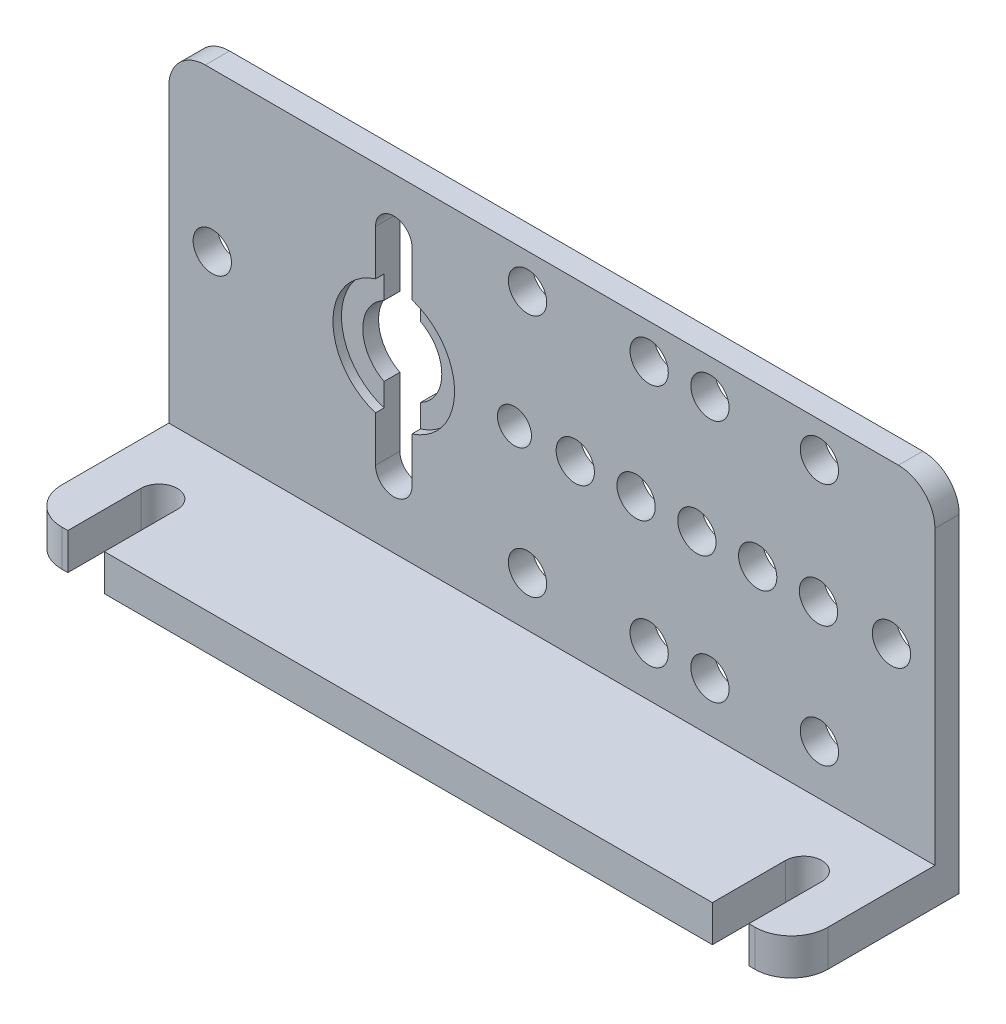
SolidWorks part; units mm, degrees
ref_plane "Plan1" through (0, 0, 0) normal (0, 0, 1) x (1, 0, 0)
ref_plane "Plan2" through (0, 0, 0) normal (0, 1, 0) x (1, 0, 0)
ref_plane "Plan3" through (0, 0, 0) normal (1, 0, 0) x (0, 0, -1)
sketch "Esquisse1" plane through (0, 0, 0) normal (0, 0, 1) x (1, 0, 0)
  line L0 (0, 0) -> (0, 27)
  line L1 (3, 30) -> (60, 30)
  line L2 (63, 27) -> (63, 0)
  line L3 (63, 0) -> (0, 0)
  arc A0 (63, 27) -> (60, 30) centre (60, 27) ccw
  arc A1 (0, 27) -> (3, 30) centre (3, 27) cw
  point P6 (63, 30)
  point P9 (0, 30)
  dimension "D3" = 3
  dimension "D1" = 30
  dimension "D2" = 63
extrude "Base-Extrusion" add sketch "Esquisse1" along normal blind 2
sketch "Esquisse2" plane through (0, 0, 0) normal (0, 1, 0) x (1, 0, 0)
  line L1 (0, -2) -> (63, -2)
  line L3 (0, -2) -> (0, -10.8)
  line L4 (3, -13.8) -> (60, -13.8)
  line L5 (63, -2) -> (63, -10.8)
  arc A0 (3, -13.8) -> (0, -10.8) centre (3, -10.8) cw
  arc A1 (63, -10.8) -> (60, -13.8) centre (60, -10.8) cw
  dimension "D1" = 3
  dimension "D2" = 11.8
  dimension "D3" = 63
extrude "Boss.-Extru.1" add sketch "Esquisse2" along normal blind 3
sketch "Esquisse5" plane through (0, 0, 2) normal (0, 0, 1) x (1, 0, 0)
  line L0 (17, 25.5) -> (17, 19.8831)
  line L1 (20, 25.5) -> (20, 19.8831)
  line L2 (20, 14.1169) -> (20, 8.5)
  line L3 (17, 14.1169) -> (17, 8.5)
  line L4 (60, 30) -> (3, 30) construction
  line L5 (0, 27) -> (0, 3) construction
  line L6 (16.4369, 27) -> (20.1358, 27) construction
  arc A0 (17, 19.8831) -> (17, 14.1169) centre (18.5, 17) ccw
  arc A1 (20, 25.5) -> (17, 25.5) centre (18.5, 25.5) ccw
  arc A2 (17, 8.5) -> (20, 8.5) centre (18.5, 8.5) ccw
  arc A3 (20, 14.1169) -> (20, 19.8831) centre (18.5, 17) ccw
  dimension "D1" = 3.25
  dimension "D2" = 1.5
  dimension "D3" = 17
  dimension "D4" = 8.5
  dimension "D5" = 1.5
  dimension "D6" = 18.5
  dimension "D7" = 13
extrude "Enlèv. mat.-Extru.1" cut sketch "Esquisse5" against normal through all
hole_wizard "Perçage3" positions "Esquisse9" profile "Esquisse8" legacy
sketch "Esquisse9" plane through (0, 0, 2) normal (0, 0, 1) x (1, 0, 0)
  arc A1 (20, 14.1169) -> (20, 19.8831) centre (18.5, 17) ccw construction
  point P0 (18.5, 17)
sketch "Esquisse8" plane through (18.5, 17, 2) normal (1, 0, 0) x (0, -1, 0)
  line L0 (0, 0) -> (0, 0.7)
  line L1 (0, 0.7) -> (5, 0.7)
  line L2 (5, 0.7) -> (5, 0)
  line L3 (5, 0) -> (0, 0)
  line L4 (0, 110) -> (0, -10) construction
  dimension "Diamètre" = 10
  dimension "Profondeur" = 0.7
sketch "Esquisse12" plane through (0, 3, 0) normal (0, 1, 0) x (-1, 0, 0)
  line L0 (-3.5, 13.8) -> (-3.5, 7.8)
  line L1 (-3, 13.8) -> (-60, 13.8) construction
  line L2 (-6.5, 13.8) -> (-6.5, 7.8)
  line L3 (-3.5, 13.8) -> (-6.5, 13.8)
  line L4 (0, 2) -> (0, 10.8) construction
  arc A0 (-3.5, 7.8) -> (-6.5, 7.8) centre (-5, 7.8) cw
  dimension "D3" = 3.5
  dimension "D1" = 3
  dimension "D2" = 6
extrude "Enlèv. mat.-Extru.3" cut sketch "Esquisse12" against normal through all
sketch "Esquisse13" plane through (0, 3, 0) normal (0, 1, 0) x (-1, 0, 0)
  line L0 (-56.5, 13.8) -> (-59.5, 13.8)
  line L1 (-6.5, 13.8) -> (-60, 13.8) construction
  line L3 (-63, 10.8) -> (-63, 2) construction
  line L15 (-56.5, 13.8) -> (-56.5, 7.8)
  line L16 (-59.5, 7.8) -> (-59.5, 13.8)
  arc A6 (-59.5, 7.8) -> (-56.5, 7.8) centre (-58, 7.8) ccw
  dimension "D1" = 3
  dimension "D2" = 3.5
extrude "Enlèv. mat.-Extru.4" cut sketch "Esquisse13" against normal through all
sketch "Esquisse18" plane through (0, 0, 2) normal (0, 0, 1) x (1, 0, 0)
  line L1 (60, 30) -> (3, 30) construction
  line L2 (2, 21.8596) -> (2, 13.8428) construction
  line L3 (61, 20.851) -> (61, 13.8428) construction
  line L4 (0, 27) -> (0, 3) construction
  line L5 (22.7349, 28.7) -> (27.7435, 28.7) construction
  line L6 (63, 3) -> (63, 27) construction
  line L7 (5.15, 19.9718) -> (5.15, 13.8428) construction
  line L8 (27.025, 20.2061) -> (27.025, 14.4831) construction
  line L9 (21.75, 20.2061) -> (21.75, 14.1484) construction
  line L10 (15.25, 20.5742) -> (15.25, 13.2003) construction
  line L11 (21.75, 5.5) -> (27.025, 5.5) construction
  line L12 (26.5, 25.55) -> (32.4935, 25.55) construction
  line L13 (30.139, 18.4) -> (25.7837, 18.4) construction
  line L14 (30.139, 15.6) -> (25.7837, 15.6) construction
  line L15 (31.775, 8.65) -> (26.5, 8.65) construction
  line L16 (6.5, 0) -> (56.5, 0) construction
  line L17 (31.075, 29.6376) -> (31.075, 24.8669) construction
  line L18 (37.925, 29.4327) -> (37.925, 25.2181) construction
  line L19 (51.925, 29.4327) -> (51.925, 25.2181) construction
  line L20 (46.075, 25.2181) -> (46.075, 28.7) construction
  circle A0 centre (3.575, 17) radius 1.575
  circle A1 centre (28.425, 17) radius 1.4
  circle A2 centre (33.425, 17) radius 1.575
  circle A3 centre (38.425, 17) radius 1.575
  circle A4 centre (43.425, 17) radius 1.575
  circle A5 centre (48.425, 17) radius 1.575
  circle A6 centre (53.425, 17) radius 1.575
  circle A7 centre (44.5, 7.075) radius 1.575
  circle A8 centre (39.5, 7.075) radius 1.575
  circle A9 centre (29.5, 7.075) radius 1.575
  circle A10 centre (29.5, 27.125) radius 1.575
  circle A11 centre (39.5, 27.125) radius 1.575
  circle A12 centre (44.5, 27.125) radius 1.575
  circle A13 centre (59.425, 17) radius 1.575
  arc A14 (17, 21.7697) -> (17, 12.2303) centre (18.5, 17) ccw construction
  arc A15 (17, 19.8831) -> (17, 14.1169) centre (18.5, 17) ccw construction
  arc A16 (20, 14.1169) -> (20, 19.8831) centre (18.5, 17) ccw construction
  circle A17 centre (53.5, 27.125) radius 1.575
  circle A18 centre (53.5, 7.075) radius 1.575
  dimension "D3" = 3.15
  dimension "D4" = 2.8
  dimension "D15" = 5
  dimension "D2" = 13
  dimension "D5" = 5
  dimension "D6" = 5
  dimension "D7" = 5
  dimension "D8" = 5
  dimension "D9" = 5
  dimension "D10" = 2
  dimension "D11" = 6
  dimension "D12" = 2
  dimension "D13" = 1.3
  dimension "D14" = 5.5
  dimension "D16" = 10
  dimension "D17" = 9
  dimension "D18" = 9.5
extrude "Enlèv. mat.-Extru.5" cut sketch "Esquisse18" against normal through all
